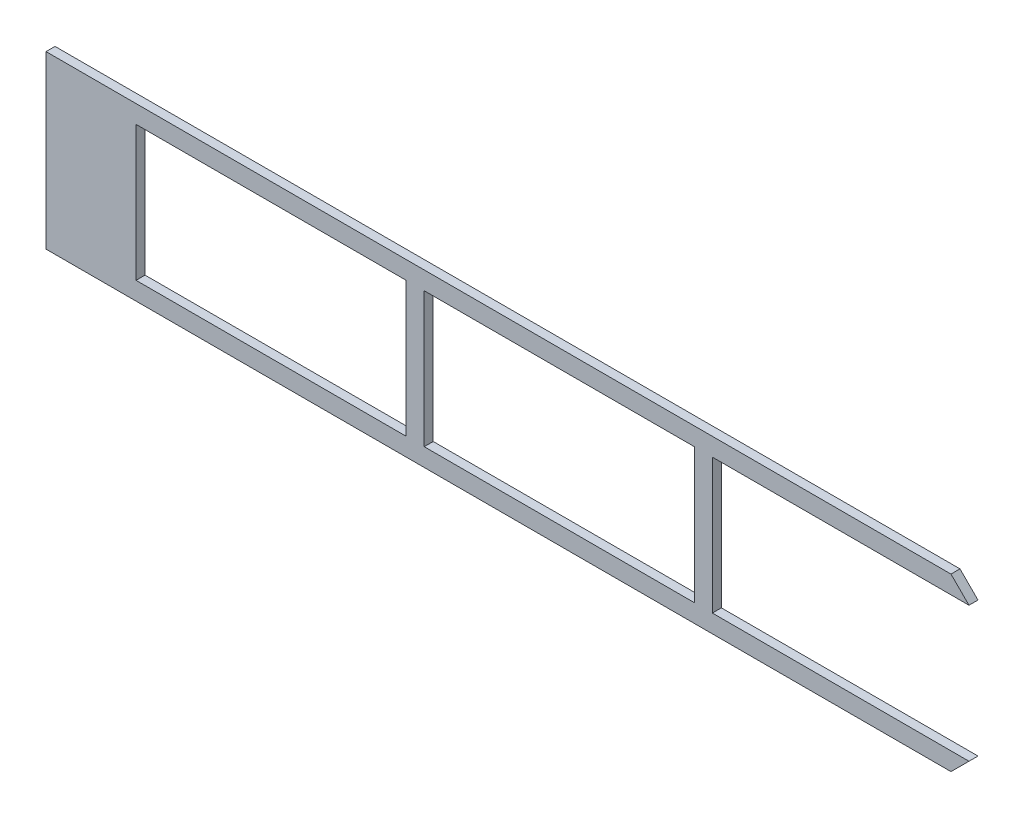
SolidWorks part; units mm, degrees
ref_plane "Plan XY" through (0, 0, 0) normal (0, 0, 1) x (1, 0, 0)
ref_plane "Plan XZ" through (0, 0, 0) normal (0, 1, 0) x (1, 0, 0)
ref_plane "Plan YZ" through (0, 0, 0) normal (1, 0, 0) x (0, 0, -1)
sketch "1 poste" plane through (0, 0, 0) normal (0, 0, 1) x (1, 0, 0)
  line L0 (2.5, 10) -> (7.5, 10) construction
  line L1 (0, 0) -> (30, 0)
  line L2 (0, 0) -> (0, 15)
  line L3 (0, 15) -> (30, 15)
  line L4 (30, 0) -> (30, 15)
  line L5 (2.5, 11.5) -> (7.5, 11.5) construction
  line L6 (2.5, 11.5) -> (2.5, 8.5) construction
  line L7 (2.5, 8.5) -> (7.5, 8.5) construction
  line L8 (7.5, 11.5) -> (7.5, 8.5) construction
  line L9 (5, 11.5) -> (5, 8.5) construction
  line L10 (-10, 17) -> (90.5, 17)
  line L11 (90.5, -2) -> (-10, -2)
  line L12 (-10, -2) -> (-10, 17)
  line L13 (90.5, 17) -> (92.5, 15)
  line L14 (92.5, 0) -> (90.5, -2)
  line L15 (-10, 7.5) -> (-13.491, 7.5) construction
  line L16 (32, 0) -> (62, 0)
  line L17 (62, 0) -> (62, 15)
  line L18 (32, 15) -> (62, 15)
  line L19 (32, 0) -> (32, 15)
  line L20 (64, 15) -> (92.5, 15)
  line L21 (64, 0) -> (64, 15)
  line L22 (64, 0) -> (92.5, 0)
  dimension "D1" = 30
  dimension "D2" = 15
  dimension "D3" = 5
  dimension "D4" = 3
  dimension "D5" = 10
  dimension "D6" = 5
  dimension "D7" = 90
  dimension "D8" = 2
  dimension "D9" = 2
  dimension "D10" = 10
  dimension "D11" = 90.5
  dimension "D13" = 2
  dimension "D15" = 2
  dimension "D12" = 2
  dimension "D14" = 2
extrude "Boss.-Extru.1" add sketch "1 poste" along normal blind 1
equation "\"D9@1 poste\"= \"D8@1 poste\""
equation "\"D13@1 poste\"= \"D8@1 poste\""
equation "\"D15@1 poste\"= \"D8@1 poste\""
